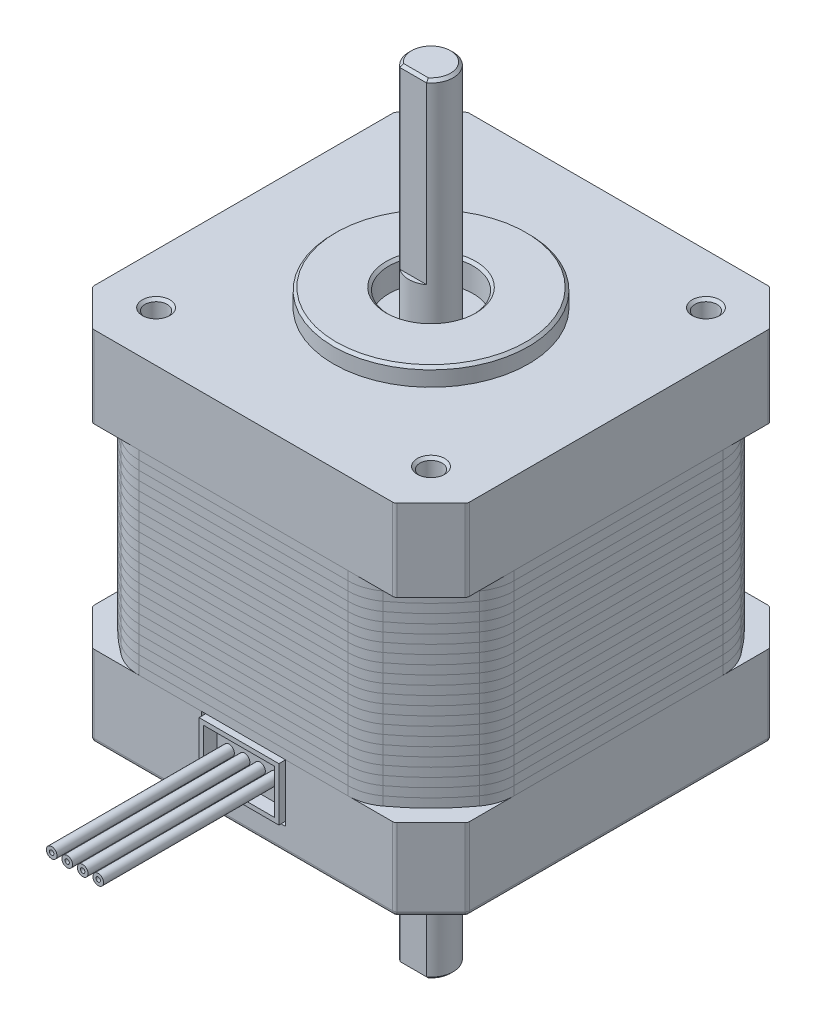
SolidWorks part; units mm, degrees
ref_plane "Спереди" through (0, 0, 0) normal (0, 0, 1) x (1, 0, 0)
ref_plane "Сверху" through (0, 0, 0) normal (0, 1, 0) x (1, 0, 0)
ref_plane "Справа" through (0, 0, 0) normal (1, 0, 0) x (0, 0, -1)
sketch "Эскиз1" plane through (0, 0, 0) normal (0, 1, 0) x (1, 0, 0)
  line L0 (-21.15, 17.0338) -> (-17.0338, 21.15)
  line L1 (-21.15, 21.15) -> (21.15, 21.15)
  line L2 (-21.15, 21.15) -> (-21.15, -21.15)
  line L3 (-21.15, -21.15) -> (21.15, -21.15)
  line L4 (21.15, 21.15) -> (21.15, -21.15)
  line L5 (-21.15, 21.15) -> (21.15, -21.15) construction
  line L6 (-21.15, -21.15) -> (21.15, 21.15) construction
  line L7 (-17.0338, 21.15) -> (17.0338, 21.15)
  line L8 (17.0338, 21.15) -> (21.15, 17.0338)
  line L9 (21.15, 17.0338) -> (21.15, -17.0338)
  line L10 (21.15, -17.0338) -> (17.0338, -21.15)
  line L11 (17.0338, -21.15) -> (-17.0338, -21.15)
  line L12 (-17.0338, -21.15) -> (-21.15, -17.0338)
  point P0 (0, 0)
  dimension "D1" = 42.3
  dimension "D2" = 54
extrude "Бобышка-Вытянуть1" add sketch "Эскиз1" along normal blind 9.2 contours L12 L3 L10 L4 L8 L1 L0 L2
sketch "Эскиз2" plane through (0, 9.2, 0) normal (0, 1, 0) x (1, 0, 0)
  line L0 (0, 21.15) -> (0, -21.15) construction
  line L1 (-21.15, 0) -> (21.15, 0) construction
  line L2 (-17.0338, 21.15) -> (17.0338, 21.15) construction
  line L3 (21.15, 17.0338) -> (21.15, -17.0338) construction
  line L25 (-11.7974, -21.15) -> (11.7974, -21.15)
  line L27 (21.15, -11.7974) -> (21.15, 11.7974)
  line L29 (11.7974, 21.15) -> (-11.7974, 21.15)
  line L31 (-21.15, 11.7974) -> (-21.15, -11.7974)
  arc A0 (-20.1875, -14.7467) -> (-14.7467, -20.1875) centre (0, 0) ccw
  arc A1 (-14.7467, 20.1875) -> (-20.1875, 14.7467) centre (0, 0) ccw
  arc A2 (20.1875, 14.7467) -> (14.7467, 20.1875) centre (0, 0) ccw
  arc A3 (14.7467, -20.1875) -> (20.1875, -14.7467) centre (0, 0) ccw
  arc A4 (14.7467, 20.1875) -> (11.7974, 21.15) centre (11.7974, 16.15) ccw
  arc A5 (21.15, 11.7974) -> (20.1875, 14.7467) centre (16.15, 11.7974) ccw
  arc A6 (20.1875, -14.7467) -> (21.15, -11.7974) centre (16.15, -11.7974) ccw
  arc A7 (11.7974, -21.15) -> (14.7467, -20.1875) centre (11.7974, -16.15) ccw
  arc A8 (-14.7467, -20.1875) -> (-11.7974, -21.15) centre (-11.7974, -16.15) ccw
  arc A9 (-20.1875, -14.7467) -> (-21.15, -11.7974) centre (-16.15, -11.7974) cw
  arc A10 (-20.1875, 14.7467) -> (-21.15, 11.7974) centre (-16.15, 11.7974) ccw
  arc A11 (-11.7974, 21.15) -> (-14.7467, 20.1875) centre (-11.7974, 16.15) ccw
  point P22 (21.15, 13.3296)
  point P27 (13.3296, -21.15)
  point P36 (-13.3296, 21.15)
  dimension "D1" = 50
  dimension "D3" = 5
extrude "Бобышка-Вытянуть3" add sketch "Эскиз2" along normal blind 1 separate body
sketch "Эскиз3" plane through (0, 0, 0) normal (0, -1, 0) x (1, 0, 0)
  circle A0 centre (0, 0) radius 4.75
  dimension "D1" = 9.5
extrude "Вырез-Вытянуть1" cut sketch "Эскиз3" against normal blind 3
sketch "Эскиз4" plane through (0, 3, 0) normal (0, -1, 0) x (1, 0, 0)
  circle A0 centre (0, 0) radius 2.5
  circle A1 centre (0, 0) radius 4.75
  dimension "D1" = 5
extrude "Вырез-Вытянуть2" cut sketch "Эскиз4" against normal blind 0.5
sketch "Эскиз5" plane through (0, 3, 0) normal (0, -1, 0) x (1, 0, 0)
  circle A0 centre (0, 0) radius 0.5
  dimension "D1" = 1
extrude "Вырез-Вытянуть3" cut sketch "Эскиз5" against normal blind 0.5
chamfer "Фаска1" distance 0.3 angle 45 1 edges at (0, 3, -2.5)
fillet "Скругление1" radius 0.5 17 edges at (0, 0, 21.15) (19.0919, 0, 19.0919) (21.15, 0, 0) (19.0919, 0, -19.0919) (0, 0, -21.15) (-19.0919, 0, -19.0919) (-21.15, 0, 0) (-19.0919, 0, 19.0919) (0, 0, -4.75) (21.15, 4.6, 17.0338) (17.0338, 4.6, 21.15) (-17.0338, 4.6, 21.15) (-21.15, 4.6, 17.0338) (-21.15, 4.6, -17.0338) (-17.0338, 4.6, -21.15) (17.0338, 4.6, -21.15) (21.15, 4.6, -17.0338)
sketch "Эскиз10" plane through (0, 0, 21.15) normal (0, 0, 1) x (1, 0, 0)
  line L0 (0, 0) -> (0, 9.2) construction
  line L1 (-11.7974, 9.2) -> (11.7974, 9.2) construction
  line L2 (-16.8267, 9.2) -> (16.8267, 9.2) construction
  line L3 (-4.75, 2.7) -> (4.75, 2.7)
  line L4 (-4.75, 2.7) -> (-4.75, 9.2)
  line L5 (-4.75, 9.2) -> (4.75, 9.2)
  line L6 (4.75, 2.7) -> (4.75, 9.2)
  line L7 (-4.75, 2.7) -> (4.75, 9.2) construction
  line L8 (-4.75, 9.2) -> (4.75, 2.7) construction
  point P5 (0, 5.95)
  dimension "D1" = 9.5
  dimension "D2" = 6.5
extrude "Вырез-Вытянуть6" cut sketch "Эскиз10" against normal blind 1
sketch "Эскиз11" plane through (0, 0, 20.15) normal (0, 0, 1) x (1, 0, 0)
  line L8 (4.5, 2.95) -> (4.5, 8.95)
  line L9 (4.5, 8.95) -> (-4.5, 8.95)
  line L10 (-4.5, 8.95) -> (-4.5, 2.95)
  line L11 (-4.5, 2.95) -> (4.5, 2.95)
  line L12 (4.5, 2.95) -> (4.5, 8.95)
  line L13 (4.5, 8.95) -> (-4.5, 8.95)
  line L14 (-4.5, 8.95) -> (-4.5, 2.95)
  line L15 (-4.5, 2.95) -> (4.5, 2.95)
  line L20 (4, 3.45) -> (4, 8.45)
  line L21 (4, 8.45) -> (-4, 8.45)
  line L22 (-4, 8.45) -> (-4, 3.45)
  line L23 (-4, 3.45) -> (4, 3.45)
  line L24 (4, 3.45) -> (4, 8.45)
  line L25 (4, 8.45) -> (-4, 8.45)
  line L26 (-4, 8.45) -> (-4, 3.45)
  line L27 (-4, 3.45) -> (4, 3.45)
  dimension "D1" = 0.25
  dimension "D2" = 0.75
extrude "Бобышка-Вытянуть6" add sketch "Эскиз11" along normal blind 1.5 separate body
sketch "Эскиз12" plane through (0, 0, 20.15) normal (0, 0, 1) x (1, 0, 0)
  line L0 (-4, 5.95) -> (4, 5.95) construction
  line L1 (-4, 8.45) -> (-4, 3.45) construction
  line L2 (4, 3.45) -> (4, 8.45) construction
  line L3 (-2.625, 5.95) -> (-2.625, 4.3362) construction
  line L4 (-2.625, 4.3362) -> (-0.875, 4.3362) construction
  line L5 (-0.875, 4.3362) -> (-0.875, 5.95) construction
  line L6 (-0.875, 5.95) -> (-0.875, 4.3362) construction
  line L7 (-0.875, 4.3362) -> (0.875, 4.3362) construction
  line L8 (0.875, 4.3362) -> (0.875, 5.95) construction
  line L9 (0.875, 5.95) -> (0.875, 4.3362) construction
  line L10 (0.875, 4.3362) -> (2.625, 4.3362) construction
  line L11 (2.625, 4.3362) -> (2.625, 5.95) construction
  line L12 (0, 5.95) -> (0, 4.3362) construction
  circle A0 centre (-2.625, 5.95) radius 0.6
  circle A1 centre (-0.875, 5.95) radius 0.6
  circle A2 centre (0.875, 5.95) radius 0.6
  circle A3 centre (2.625, 5.95) radius 0.6
  circle A4 centre (-2.625, 5.95) radius 0.25
  circle A5 centre (-0.875, 5.95) radius 0.25
  circle A6 centre (0.875, 5.95) radius 0.25
  circle A7 centre (2.625, 5.95) radius 0.25
  dimension "D1" = 1.2
  dimension "D2" = 0.5
  dimension "D3" = 1.75
extrude "Бобышка-Вытянуть7" add sketch "Эскиз12" along normal blind 15 separate body
extrude "Бобышка-Вытянуть8" add sketch "Эскиз12" along normal blind 20 separate body
pattern_linear "Линейный массив1" count 22 spacing 1 along (0, 1, 0) of "Бобышка-Вытянуть3"
ref_plane "Плоскость1" through (0, 31.2, 0) normal (0, 1, 0) x (1, 0, 0)
sketch "Эскиз19" plane through (0, 31.2, 0) normal (0, 1, 0) x (1, 0, 0)
  line L0 (-21.0036, 17.1802) -> (-17.1802, 21.0036) construction
  line L7 (-21.15, 16.8267) -> (-21.15, -16.8267) construction
  line L8 (16.8267, 21.15) -> (-16.8267, 21.15) construction
  line L10 (17.1802, 21.0036) -> (21.0036, 17.1802) construction
  line L16 (21.0036, -17.1802) -> (17.1802, -21.0036) construction
  line L18 (-17.1802, -21.0036) -> (-21.0036, -17.1802) construction
  line L20 (-16.8267, -21.15) -> (16.8267, -21.15) construction
  line L21 (21.15, -16.8267) -> (21.15, 16.8267) construction
  line L24 (-21.15, 17.0338) -> (-21.15, -17.0338)
  line L25 (-21.15, -17.0338) -> (-17.0338, -21.15)
  line L26 (-17.0338, -21.15) -> (17.0338, -21.15)
  line L27 (17.0338, -21.15) -> (21.15, -17.0338)
  line L28 (21.15, -17.0338) -> (21.15, 17.0338)
  line L29 (21.15, 17.0338) -> (17.0338, 21.15)
  line L30 (17.0338, 21.15) -> (-17.0338, 21.15)
  line L31 (-17.0338, 21.15) -> (-21.15, 17.0338)
extrude "Бобышка-Вытянуть15" add sketch "Эскиз19" along normal blind 9.2
sketch "Эскиз20" plane through (0, 40.4, 0) normal (0, 1, 0) x (1, 0, 0)
  line L1 (-15.5, 15.5) -> (15.5, 15.5) construction
  line L2 (-15.5, 15.5) -> (-15.5, -15.5) construction
  line L3 (-15.5, -15.5) -> (15.5, -15.5) construction
  line L4 (15.5, 15.5) -> (15.5, -15.5) construction
  line L5 (-15.5, 15.5) -> (15.5, -15.5) construction
  line L6 (-15.5, -15.5) -> (15.5, 15.5) construction
  circle A0 centre (-15.5, 15.5) radius 1.25
  circle A1 centre (15.5, 15.5) radius 1.25
  circle A2 centre (15.5, -15.5) radius 1.25
  circle A3 centre (-15.5, -15.5) radius 1.25
  point P0 (0, 0)
  dimension "D1" = 2.5
  dimension "D2" = 31
extrude "Вырез-Вытянуть7" cut sketch "Эскиз20" against normal blind 7
sketch "Эскиз21" plane through (0, 40.4, 0) normal (0, 1, 0) x (1, 0, 0)
  circle A0 centre (0, 0) radius 4.75
  dimension "D1" = 9.5
extrude "Вырез-Вытянуть8" cut sketch "Эскиз21" against normal blind 1
sketch "Эскиз22" plane through (0, 40.4, 0) normal (0, 1, 0) x (1, 0, 0)
  circle A0 centre (0, 0) radius 11
  circle A1 centre (0, 0) radius 4.75
  dimension "D1" = 22
  dimension "D2" = 9.5
extrude "Бобышка-Вытянуть16" add sketch "Эскиз22" along normal blind 2
fillet "Скругление2" radius 0.5 8 edges at (-17.0338, 35.8, -21.15) (-21.15, 35.8, -17.0338) (-21.15, 35.8, 17.0338) (-17.0338, 35.8, 21.15) (17.0338, 35.8, 21.15) (21.15, 35.8, 17.0338) (17.0338, 35.8, -21.15) (21.15, 35.8, -17.0338)
chamfer "Фаска2" distance 0.3 angle 45 6 edges at (15.5, 40.4, -14.25) (-15.5, 40.4, -14.25) (-15.5, 40.4, 16.75) (15.5, 40.4, 16.75) (0, 42.4, 4.75) (0, 42.4, 11)
sketch "Эскиз23" plane through (0, 39.4, 0) normal (0, 1, 0) x (1, 0, 0)
  circle A0 centre (0, 0) radius 2.5
  dimension "D1" = 5
extrude "Бобышка-Вытянуть17" add sketch "Эскиз23" along normal blind 25
sketch "Эскиз24" plane through (0, 64.4, 0) normal (0, 1, 0) x (1, 0, 0)
  line L0 (0, 2.5) -> (0, -2.5) construction
  line L1 (-1.5, -2) -> (1.5, -2)
  circle A0 centre (0, 0) radius 2.5 construction
  circle A1 centre (0, 0) radius 2.5 construction
  arc A2 (-1.5, -2) -> (1.5, -2) centre (0, 0) ccw
  dimension "D1" = 0.5
extrude "Вырез-Вытянуть9" cut sketch "Эскиз24" against normal blind 20
chamfer "Фаска3" distance 0.3 angle 45 2 edges at (0, 64.4, -2.5) (0, 64.4, 2)
sketch "Эскиз25" plane through (0, 3.5, 0) normal (0, -1, 0) x (1, 0, 0)
  circle A0 centre (0, 0) radius 2.5
  dimension "D1" = 5
extrude "Бобышка-Вытянуть18" add sketch "Эскиз25" along normal blind 27
sketch "Эскиз26" plane through (0, -23.5, 0) normal (0, -1, 0) x (1, 0, 0)
  line L0 (0, -2.5) -> (0, 2.5) construction
  line L1 (-1.5, 2) -> (1.5, 2)
  circle A0 centre (0, 0) radius 2.5 construction
  circle A1 centre (0, 0) radius 2.5 construction
  arc A2 (-1.5, 2) -> (1.5, 2) centre (0, 0) cw
  dimension "D1" = 0.5
extrude "Вырез-Вытянуть10" cut sketch "Эскиз26" against normal blind 20
chamfer "Фаска4" distance 0.3 angle 45 2 edges at (0, -23.5, -2.5) (0, -23.5, 2)
